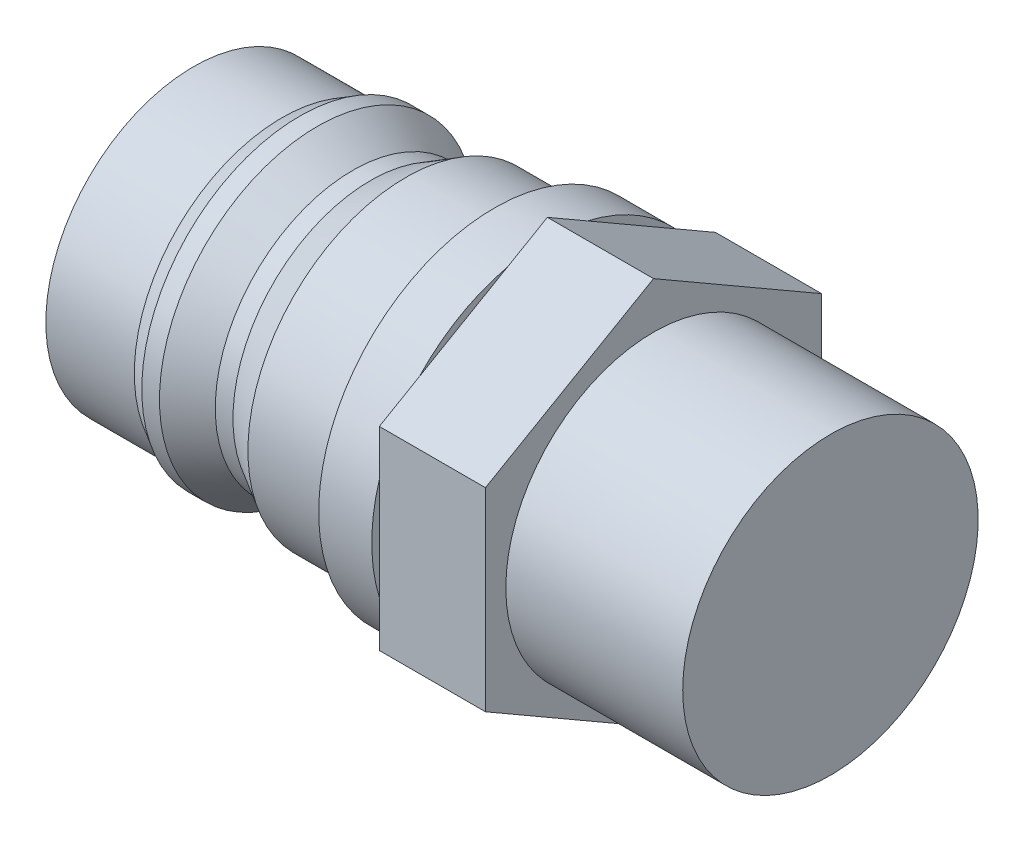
SolidWorks part; units mm, degrees
ref_plane "Alzado" through (0, 0, 0) normal (0, 0, 1) x (1, 0, 0)
ref_plane "Planta" through (0, 0, 0) normal (0, 1, 0) x (1, 0, 0)
ref_plane "Vista lateral" through (0, 0, 0) normal (1, 0, 0) x (0, 0, -1)
sketch "Croquis1" plane through (0, 0, 0) normal (0, 0, 1) x (1, 0, 0)
  line L0 (0, 0) -> (20, 0) construction
  line L1 (0, 0) -> (0, 8.35)
  line L2 (0, 8.35) -> (5, 8.35)
  line L3 (5, 8.35) -> (6, 8.9274)
  line L4 (6, 8.9274) -> (7, 8.9274)
  line L5 (6.5, 8.9274) -> (6.5, 0) construction
  line L6 (8, 8.35) -> (7, 8.9274)
  line L7 (8, 8.35) -> (9, 7.7726)
  line L8 (9, 7.7726) -> (10, 7.7726)
  line L9 (9.5, 7.7726) -> (9.5, 0) construction
  line L10 (11, 8.35) -> (10, 7.7726)
  line L11 (11, 8.35) -> (12, 8.9274)
  line L12 (12, 8.9274) -> (17, 8.9274)
  line L14 (20, 0) -> (0, 0)
  line L15 (17, 8.9274) -> (17, 9.9274)
  line L16 (17, 9.9274) -> (20, 9.9274)
  line L17 (20, 9.9274) -> (20, 0)
  point P18 (27.5743, 0)
  dimension "D1" = 16.7
  dimension "D2" = 5
  dimension "D3" = 1
  dimension "D4" = 1
  dimension "D5" = 150
  dimension "D6" = 1
  dimension "D7" = 1
  dimension "D8" = 5
  dimension "D9" = 1
  dimension "D10" = 3
revolve "Revolución1" add sketch "Croquis1" angle 360 about L14
sketch "Croquis8" plane through (20, 0, 0) normal (1, 0, 0) x (0, 0, -1)
  line L1 (0, 10.9697) -> (-9.5, 5.4848)
  line L2 (-9.5, 5.4848) -> (-9.5, -5.4848)
  line L3 (-9.5, -5.4848) -> (0, -10.9697)
  line L4 (0, -10.9697) -> (9.5, -5.4848)
  line L5 (9.5, -5.4848) -> (9.5, 5.4848)
  line L6 (9.5, 5.4848) -> (0, 10.9697)
  circle A0 centre (0, 0) radius 9.5 construction
  dimension "D1" = 19
extrude "Saliente-Extruir6" add sketch "Croquis8" along normal blind 6
sketch "Croquis11" plane through (0, 0, 0) normal (0, 0, 1) x (1, 0, 0)
  line L0 (26, 0) -> (52.1801, 0) construction
  line L1 (26, 5.4848) -> (26, -5.4848) construction
  line L2 (26, 0) -> (26, 8.35)
  line L3 (26, 8.35) -> (36, 8.35)
  line L4 (36, 8.35) -> (36, 0)
  line L5 (36, 0) -> (26, 0)
  dimension "D1" = 16.7
  dimension "D2" = 10
revolve "Revolución4" add sketch "Croquis11" angle 360 about L0
